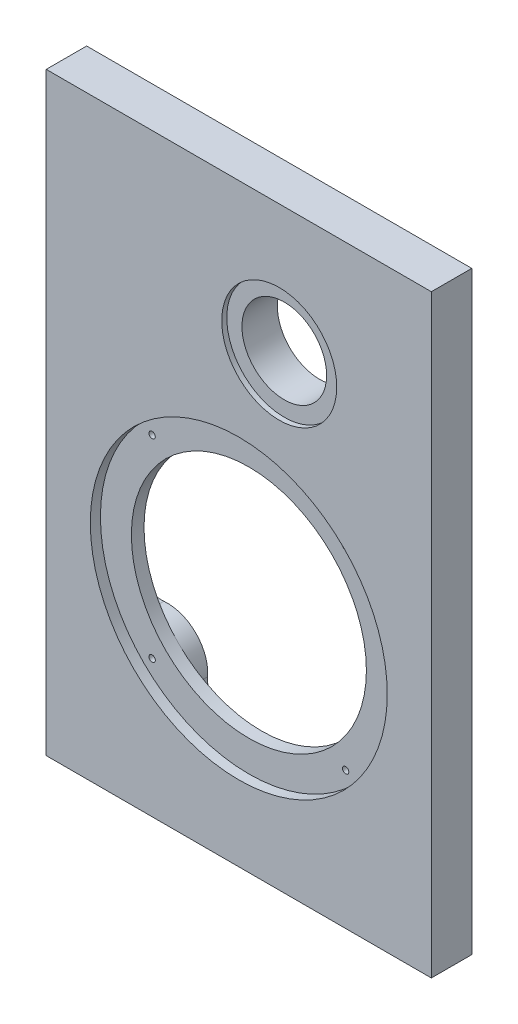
SolidWorks part; units mm, degrees
ref_plane "Front Plane" through (0, 0, 0) normal (0, 0, 1) x (1, 0, 0)
ref_plane "Top Plane" through (0, 0, 0) normal (0, 1, 0) x (1, 0, 0)
ref_plane "Right Plane" through (0, 0, 0) normal (1, 0, 0) x (0, 0, -1)
sketch "Sketch1" plane through (0, 0, 0) normal (0, 0, 1) x (1, 0, 0)
  line L1 (-76.2, 117.6) -> (76.2, 117.6)
  line L2 (-76.2, 117.6) -> (-76.2, -117.6)
  line L3 (-76.2, -117.6) -> (76.2, -117.6)
  line L4 (76.2, 117.6) -> (76.2, -117.6)
  line L5 (-76.2, 117.6) -> (76.2, -117.6) construction
  line L6 (-76.2, -117.6) -> (76.2, 117.6) construction
  circle A0 centre (0, -29.05) radius 46.5
  circle A1 centre (16, 66.2) radius 16.75
  point P0 (0, 0)
  dimension "D3" = 93
  dimension "D4" = 33.5
  dimension "D1" = 152.4
  dimension "D2" = 235.2
  dimension "D5" = 92.2
  dimension "D6" = 51.4
  dimension "D7" = 146.65
extrude "Boss-Extrude1" add sketch "Sketch1" along normal blind 16
sketch "Sketch2" plane through (0, 0, 16) normal (0, 0, 1) x (1, 0, 0)
  circle A1 centre (16, 66.2) radius 22.75
  dimension "D2" = 45.5
extrude "Cut-Extrude1" cut sketch "Sketch2" against normal blind 2
sketch "Sketch5" plane through (0, 0, 16) normal (0, 0, 1) x (1, 0, 0)
  circle A0 centre (0, -29.05) radius 58.75
  dimension "D1" = 117.5
extrude "Cut-Extrude3" cut sketch "Sketch5" against normal blind 4
sketch "Sketch6" plane through (0, 0, 12) normal (0, 0, 1) x (1, 0, 0)
  line L0 (0, -29.05) -> (-38.2898, 9.2398) construction
  line L1 (0, -29.05) -> (-38.2898, -67.3398) construction
  line L2 (0, -29.05) -> (0, 44.1947) construction
  circle A0 centre (0, -29.05) radius 54.15 construction
  circle A1 centre (-38.2898, 9.2398) radius 1.25
  circle A2 centre (-38.2898, -67.3398) radius 1.25
  circle A3 centre (38.2898, -67.3398) radius 1.25
  circle A4 centre (38.2898, 9.2398) radius 1.25
  dimension "D1" = 108.3
  dimension "D4" = 2.5
  dimension "D2" = 45
  dimension "D3" = 90
extrude "Cut-Extrude4" cut sketch "Sketch6" against normal blind 5
sketch "Sketch7" plane through (0, 0, 0) normal (0, 0, -1) x (-1, 0, 0)
  line L0 (0, -29.05) -> (38.2898, 9.2398) construction
  line L1 (38.2898, 9.2398) -> (44.2639, 15.2139) construction
  line L2 (0, -29.05) -> (38.2898, -67.3398) construction
  line L3 (38.2898, -67.3398) -> (44.2639, -73.3139) construction
  line L4 (0, -29.05) -> (0, -7.5743) construction
  arc A0 (-51.8439, 1.1528) -> (-51.8436, -59.2534) centre (0, -29.05) ccw
  arc A1 (30.2028, 22.7939) -> (51.8439, 1.1528) centre (44.2639, 15.2139) ccw
  arc A2 (51.8436, -59.2534) -> (30.2034, -80.8936) centre (44.2639, -73.3139) ccw
  arc A3 (-51.8436, -59.2534) -> (-30.2034, -80.8936) centre (-44.2639, -73.3139) cw
  arc A4 (-30.2028, 22.7939) -> (-51.8439, 1.1528) centre (-44.2639, 15.2139) cw
  arc A5 (30.2028, 22.7939) -> (-30.2028, 22.7939) centre (0, -29.05) ccw
  arc A6 (51.8436, -59.2534) -> (51.8439, 1.1528) centre (0, -29.05) ccw
  arc A7 (-30.2034, -80.8936) -> (30.2034, -80.8936) centre (0, -29.05) ccw
  dimension "D1" = 60
extrude "Cut-Extrude5" cut sketch "Sketch7" against normal offset from surface (7 mm away) 5
fillet "Fillet1" radius 10 8 edges at (51.8436, -59.2534, 3.5) (30.2034, -80.8936, 3.5) (-30.2034, -80.8936, 3.5) (-51.8436, -59.2534, 3.5) (-30.2028, 22.7939, 3.5) (-51.8439, 1.1528, 3.5) (51.8439, 1.1528, 3.5) (30.2028, 22.7939, 3.5)
fillet "Fillet3" [suppressed] radius 12
ref_plane "Plane1" through (0, 0, 8) normal (0, 0, -1) x (-1, 0, 0)
chamfer "Chamfer1" [suppressed] distance 12 angle 45
